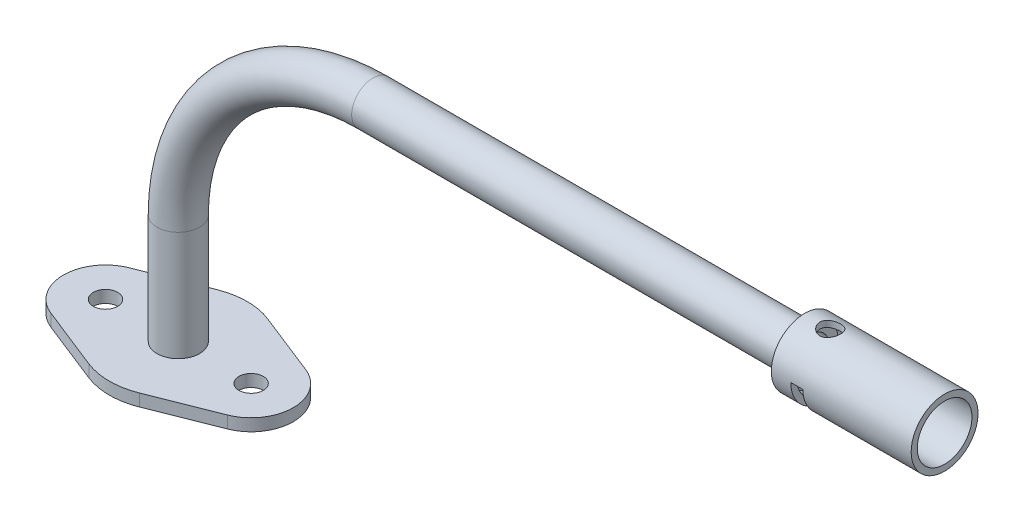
SolidWorks part; units mm, degrees
ref_plane "Front" through (0, 0, 0) normal (0, 0, 1) x (1, 0, 0)
ref_plane "Top" through (0, 0, 0) normal (0, 1, 0) x (1, 0, 0)
ref_plane "Right" through (0, 0, 0) normal (1, 0, 0) x (0, 0, -1)
sketch "Sketch1" plane through (0, 0, 0) normal (0, 0, 1) x (1, 0, 0)
  line L0 (0, 0) -> (0, 31.75)
  line L1 (50.8, 82.55) -> (165.1, 82.55)
  arc A0 (0, 31.75) -> (50.8, 82.55) centre (50.8, 31.75) cw
  dimension "D1" = 50.8
  dimension "D2" = 82.55
  dimension "D3" = 165.1
sketch "Sketch2" plane through (0, 0, 0) normal (0, 1, 0) x (1, 0, 0)
  circle A0 centre (0, 0) radius 5.5562
  dimension "D1" = 11.1125
sweep "Base-Sweep" add profiles "Sketch2" path "Sketch1"
sketch "Sketch3" plane through (0, 0, 0) normal (0, -1, 0) x (1, 0, 0)
  line L0 (0, 0) -> (0, -41.2826) construction
  line L1 (0, 0) -> (65.551, 0) construction
  line L2 (-6.6316, -16.7339) -> (-23.0526, -10.2262)
  line L3 (-6.6316, 16.7339) -> (-23.0526, 10.2262)
  line L4 (6.6316, -16.7339) -> (23.0526, -10.2262)
  line L5 (6.6316, 16.7339) -> (23.0526, 10.2262)
  arc A0 (-23.0526, -10.2262) -> (-23.0526, 10.2262) centre (-19, 0) cw
  arc A1 (23.0526, -10.2262) -> (23.0526, 10.2262) centre (19, 0) ccw
  arc A2 (-6.6316, -16.7339) -> (6.6316, -16.7339) centre (0, 0) ccw
  arc A3 (6.6316, 16.7339) -> (-6.6316, 16.7339) centre (0, 0) ccw
  dimension "D1" = 18
  dimension "D2" = 11
  dimension "D3" = 38
extrude "Boss-Extrude1" add sketch "Sketch3" against normal blind 3.175
ref_plane "Plane4" through (0, 82.55, 0) normal (0, 1, 0) x (-1, 0, 0)
sketch "Sketch4" plane through (0, 82.55, 0) normal (0, 1, 0) x (-1, 0, 0)
  line L0 (-165.1, 0) -> (-165.1, -7.1438)
  line L1 (-165.1, -7.1438) -> (-200.025, -7.1438)
  line L2 (-165.1, 0) -> (-237.5687, 0) construction
  dimension "D1" = 14.2875
  dimension "D2" = 34.925
revolve "Boss-Revolve-Thin1" add sketch "Sketch4" angle 360 about L2
sketch "Sketch5" plane through (165.1, 0, 0) normal (1, 0, 0) x (0, 0, -1)
  circle A0 centre (0, 82.55) radius 4.7625
  dimension "D1" = 9.525
sketch "Sketch6" plane through (0, 0, 0) normal (0, 0, 1) x (1, 0, 0)
  line L0 (0, 0) -> (0, 31.75) construction
  line L1 (50.8, 82.55) -> (165.1, 82.55) construction
  line L2 (0, 0) -> (0, 31.75)
  line L3 (50.8, 82.55) -> (165.1, 82.55)
  arc A0 (50.8, 82.55) -> (0, 31.75) centre (50.8, 31.75) ccw construction
  arc A1 (50.8, 82.55) -> (0, 31.75) centre (50.8, 31.75) ccw
sweep "Cut-Sweep1" cut profiles "Sketch5" path "Sketch6"
sketch "Sketch7" plane through (0, 3.175, 0) normal (0, 1, 0) x (-1, 0, 0)
  circle A0 centre (-19, 0) radius 3.175
  circle A1 centre (19, 0) radius 3.175
  arc A2 (23.0526, -10.2262) -> (23.0526, 10.2262) centre (19, 0) ccw construction
  dimension "D1" = 6.35
extrude "Cut-Extrude1" cut sketch "Sketch7" against normal through all
ref_plane "Plane5" through (0, 82.55, 0) normal (0, 1, 0) x (-1, 0, 0)
sketch "Sketch8" plane through (0, 82.55, 0) normal (0, 1, 0) x (-1, 0, 0)
  line L0 (-168.5925, 0) -> (-171.7675, 0)
  line L1 (-168.5925, 0) -> (-168.5925, 15.875)
  line L2 (-171.7675, 15.875) -> (-168.5925, 15.875)
  line L3 (-171.7675, 15.875) -> (-171.7675, 0)
  line L5 (-50.8, 0) -> (-163.5125, 0) construction
  line L6 (-163.5125, 8.7313) -> (-163.5125, -8.7313) construction
  line L7 (-168.5925, 0) -> (-153.1921, 0) construction
  dimension "D1" = 5.08
  dimension "D2" = 3.175
  dimension "D3" = 15.875
revolve "Cut-Revolve1" cut sketch "Sketch8" angle 90 about L7
sketch "Sketch9" plane through (0, 82.55, 0) normal (0, 1, 0) x (-1, 0, 0)
  line L0 (-50.8, 0) -> (-163.5125, 0) construction
  line L1 (-168.5925, 0) -> (-171.7675, 0) construction
  circle A0 centre (-170.18, 0) radius 2.6988
  dimension "D1" = 5.3975
extrude "Cut-Extrude2" cut sketch "Sketch9" along normal through all
